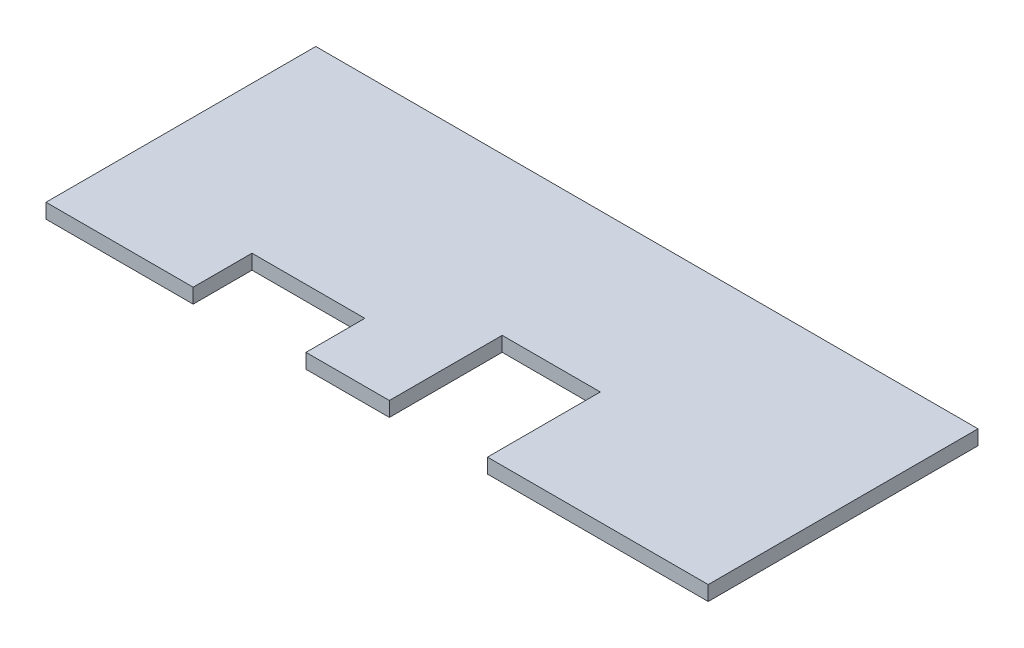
SolidWorks part; units mm, degrees
ref_plane "Front Plane" through (0, 0, 0) normal (0, 0, 1) x (1, 0, 0)
ref_plane "Top Plane" through (0, 0, 0) normal (0, 1, 0) x (1, 0, 0)
ref_plane "Right Plane" through (0, 0, 0) normal (1, 0, 0) x (0, 0, -1)
sketch "Sketch1" plane through (0, 0, 0) normal (0, 1, 0) x (1, 0, 0)
  line L1 (-67.5, -27.5) -> (67.5, -27.5)
  line L2 (-67.5, -27.5) -> (-67.5, 27.5)
  line L3 (-67.5, 27.5) -> (67.5, 27.5)
  line L4 (67.5, -27.5) -> (67.5, 27.5)
  line L5 (-67.5, -27.5) -> (67.5, 27.5) construction
  line L6 (-67.5, 27.5) -> (67.5, -27.5) construction
  line L7 (-67.5, -27.5) -> (-14.5, -27.5)
  line L8 (-67.5, -27.5) -> (-67.5, -15.5)
  line L9 (-67.5, -15.5) -> (-14.5, -15.5)
  line L10 (-14.5, -27.5) -> (-14.5, -15.5)
  line L11 (-67.5, -15.5) -> (-37.5, -15.5)
  line L12 (-67.5, -15.5) -> (-67.5, -27.5)
  line L13 (-67.5, -27.5) -> (-37.5, -27.5)
  line L14 (-37.5, -15.5) -> (-37.5, -27.5)
  line L15 (2.5, -27.5) -> (22.5, -27.5)
  line L16 (2.5, -27.5) -> (2.5, -4.5)
  line L17 (2.5, -4.5) -> (22.5, -4.5)
  line L18 (22.5, -27.5) -> (22.5, -4.5)
  point P0 (0, 0)
  dimension "D1" = 55
  dimension "D2" = 135
  dimension "D3" = 53
  dimension "D4" = 12
  dimension "D5" = 30
  dimension "D6" = 17
  dimension "D7" = 23
  dimension "D8" = 20
extrude "Boss-Extrude1" add sketch "Sketch1" along normal blind 3 contours L10 L1 L4 L3 L2 L9 | L14 L9 L2 L1
